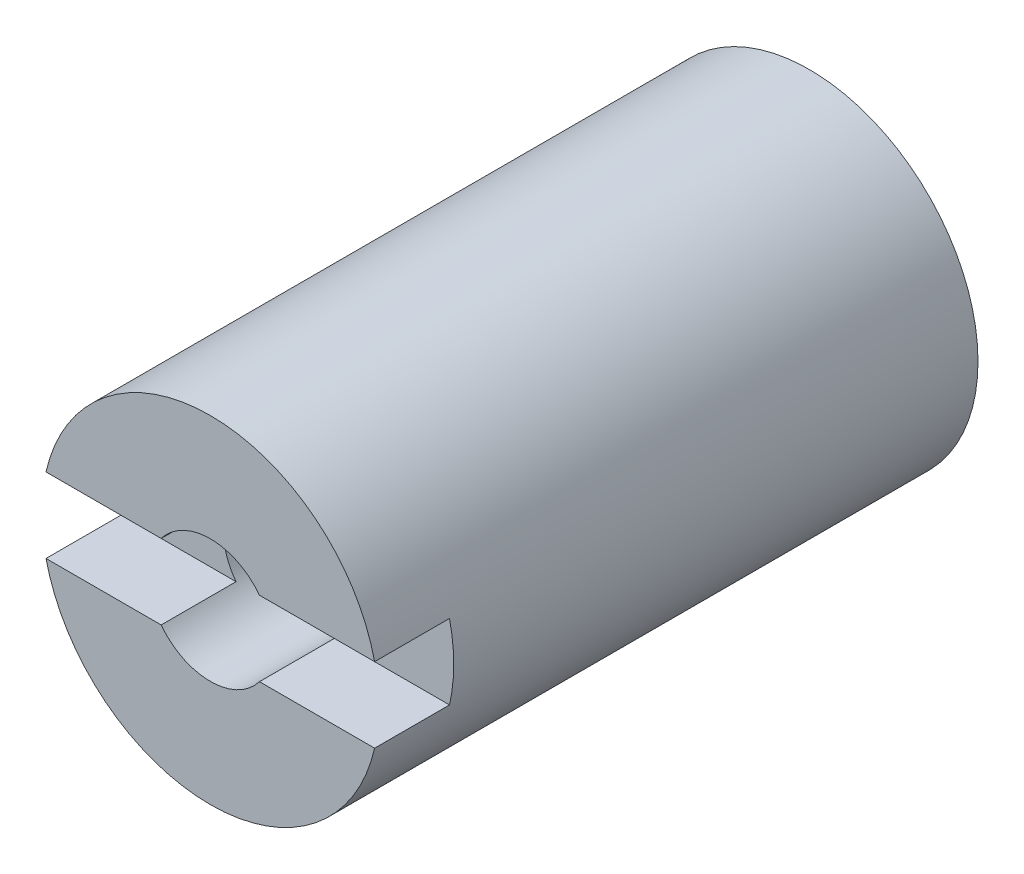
SolidWorks part; units mm, degrees
ref_plane "Face" through (0, 0, 0) normal (0, 0, 1) x (1, 0, 0)
ref_plane "Dessus" through (0, 0, 0) normal (0, 1, 0) x (1, 0, 0)
ref_plane "Droite" through (0, 0, 0) normal (1, 0, 0) x (0, 0, -1)
sketch "Esquisse1" plane through (0, 0, 0) normal (0, 0, 1) x (1, 0, 0)
  circle A0 centre (0, 0) radius 4.5
  dimension "D1" = 9
extrude "Base-Extrusion" add sketch "Esquisse1" against normal blind 16
hole_wizard "M4x0.7 Trou taraudé1" positions "Esquisse3" profile "Esquisse2"
sketch "Esquisse3" plane through (0, 0, 0) normal (0, 0, 1) x (1, 0, 0)
  circle A0 centre (0, 0) radius 4.5 construction
  point P0 (0, 0)
sketch "Esquisse2" plane through (0, 0, 0) normal (1, 0, 0) x (0, -1, 0)
  line L0 (0, 0) -> (0, 16)
  line L1 (0, 16) -> (1.65, 16)
  line L2 (1.65, 16) -> (1.65, 0)
  line L5 (1.65, 0) -> (0, 0)
  line L11 (0, -6.35) -> (0, 107.95) construction
  dimension "Diamètre du perçage jusqu'au prochain" = 3.3
  dimension "Profondeur du perçage jusqu'au prochain" = 16
extrude "Enlèv. mat.-Extru.1" cut sketch "Esquisse4" against normal blind 2
sketch "Esquisse4" plane through (0, 0, 0) normal (0, 0, 1) x (1, 0, 0)
  line L1 (-4.3875, 1) -> (4.3875, 1)
  line L3 (-4.3875, -1) -> (4.3875, -1)
  circle A0 centre (0, 0) radius 4.5 construction
  arc A1 (-4.3875, 1) -> (-4.3875, -1) centre (0, 0) ccw
  arc A2 (4.3875, -1) -> (4.3875, 1) centre (0, 0) ccw
  dimension "D1" = 1
  dimension "D2" = 2
